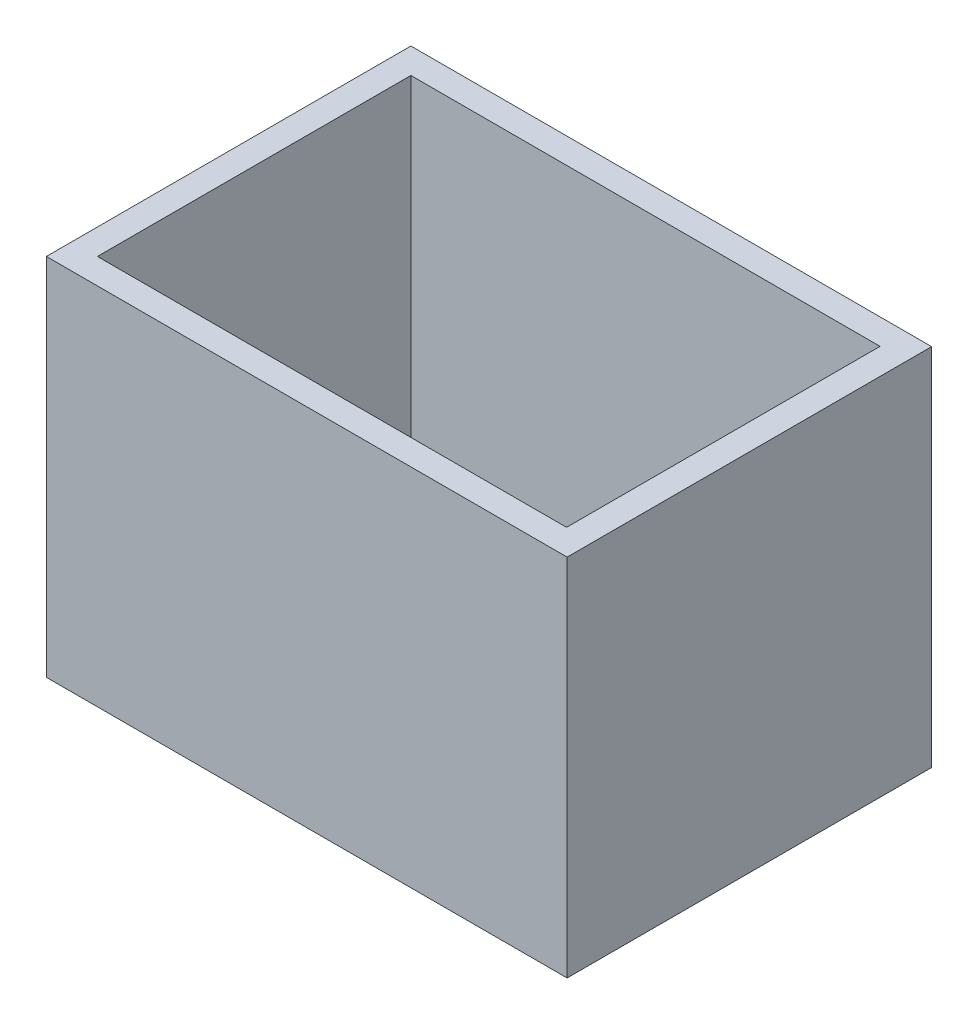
SolidWorks part; units mm, degrees
ref_plane "Front Plane" through (0, 0, 0) normal (0, 0, 1) x (1, 0, 0)
ref_plane "Top Plane" through (0, 0, 0) normal (0, 1, 0) x (1, 0, 0)
ref_plane "Right Plane" through (0, 0, 0) normal (1, 0, 0) x (0, 0, -1)
sketch "Sketch1" plane through (0, 0, 0) normal (0, 1, 0) x (1, 0, 0)
  line L1 (-76.2962, 34.5933) -> (50.7038, 34.5933)
  line L2 (-76.2962, 34.5933) -> (-76.2962, -54.3067)
  line L3 (-76.2962, -54.3067) -> (50.7038, -54.3067)
  line L4 (50.7038, 34.5933) -> (50.7038, -54.3067)
  dimension "D1" = 127
  dimension "D2" = 88.9
extrude "Boss-Extrude1" add sketch "Sketch1" along normal blind 88.9
sketch "Sketch2" plane through (0, 88.9, 0) normal (0, 1, 0) x (1, 0, 0)
  line L1 (-70.0732, 28.3703) -> (44.3538, 28.3703)
  line L2 (-70.0732, 28.3703) -> (-70.0732, -48.0837)
  line L3 (-70.0732, -48.0837) -> (44.3538, -48.0837)
  line L4 (44.3538, 28.3703) -> (44.3538, -48.0837)
  line L5 (-76.2962, 34.5933) -> (-76.2962, -54.3067) construction
  line L6 (50.7038, 34.5933) -> (-76.2962, 34.5933) construction
  dimension "D1" = 76.454
  dimension "D2" = 114.427
  dimension "D3" = 6.223
  dimension "D4" = 6.223
extrude "Cut-Extrude1" cut sketch "Sketch2" against normal through all
